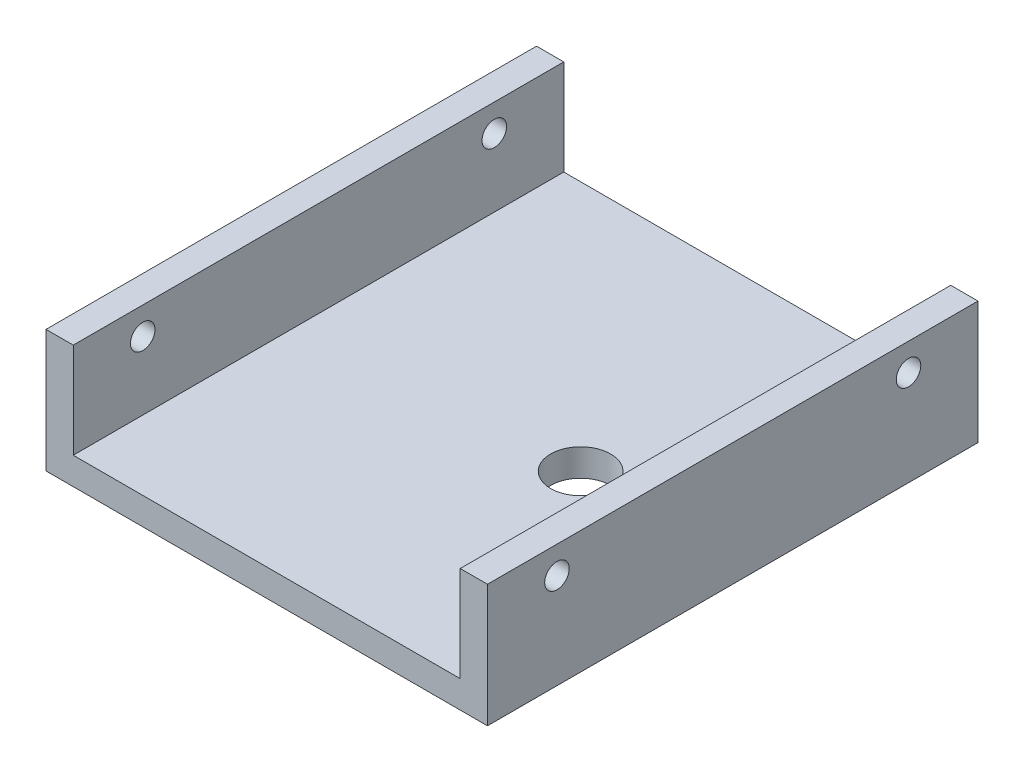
SolidWorks part; units mm, degrees
ref_plane "Plan de face" through (0, 0, 0) normal (0, 0, 1) x (1, 0, 0)
ref_plane "Plan de dessus" through (0, 0, 0) normal (0, 1, 0) x (1, 0, 0)
ref_plane "Plan de droite" through (0, 0, 0) normal (1, 0, 0) x (0, 0, -1)
sketch "Esquisse1" plane through (0, 0, 0) normal (0, 0, 1) x (1, 0, 0)
  line L0 (0, 35) -> (0, 0)
  line L1 (0, 0) -> (142, 0)
  line L2 (142, 0) -> (142, 35)
  line L3 (-10, 35) -> (-10, -10)
  line L4 (-10, -10) -> (152, -10)
  line L5 (152, -10) -> (152, 35)
  line L6 (-10, 35) -> (0, 35)
  line L7 (142, 35) -> (152, 35)
  dimension "D2" = 162
  dimension "D3" = 35
  dimension "D4" = 35
  dimension "D1" = 10
extrude "Extrusion1" add sketch "Esquisse1" along normal blind 180
hole_wizard "Dégagement M81" positions "Esquisse3" profile "Esquisse4" hole size "M8" standard "ISO"
sketch "Esquisse3" plane through (152, 0, 0) normal (1, 0, 0) x (0, 0, -1)
  line L0 (-180, -10) -> (0, -10) construction
  line L1 (-180, -10) -> (-180, 35) construction
  point P0 (-154.5, 25)
  dimension "D1" = 35
  dimension "D2" = 25.5
sketch "Esquisse4" plane through (152, 25, 154.5) normal (0, 1, 0) x (0, 0, -1)
  line L0 (0, 0) -> (0, 162)
  line L1 (0, 162) -> (4.5, 162)
  line L2 (4.5, 162) -> (4.5, 0)
  line L5 (4.5, 0) -> (0, 0)
  line L11 (0, -6.35) -> (0, 107.95) construction
  dimension "Diamètre du perçage jusqu'au prochain" = 9
  dimension "Profondeur du perçage jusqu'au prochain" = 162
pattern_linear "Répétition linéaire1" count 2 spacing 129 along (0, 0, -1) of "Dégagement M81"
hole_wizard "Dégagement M201" positions "Esquisse6" profile "Esquisse7" hole size "M20" standard "ISO"
sketch "Esquisse6" plane through (0, -10, 0) normal (0, -1, 0) x (1, 0, 0)
  line L0 (-10, 0) -> (152, 0) construction
  line L1 (152, 180) -> (152, 0) construction
  point P0 (98.18, 92)
  dimension "D1" = 92
  dimension "D2" = 53.82
sketch "Esquisse7" plane through (98.18, -10, 92) normal (1, 0, 0) x (0, 0, -1)
  line L0 (0, 0) -> (0, 10)
  line L1 (0, 10) -> (11, 10)
  line L2 (11, 10) -> (11, 0)
  line L5 (11, 0) -> (0, 0)
  line L11 (0, -6.35) -> (0, 107.95) construction
  dimension "Diamètre du perçage jusqu'au prochain" = 22
  dimension "Profondeur du perçage jusqu'au prochain" = 10
